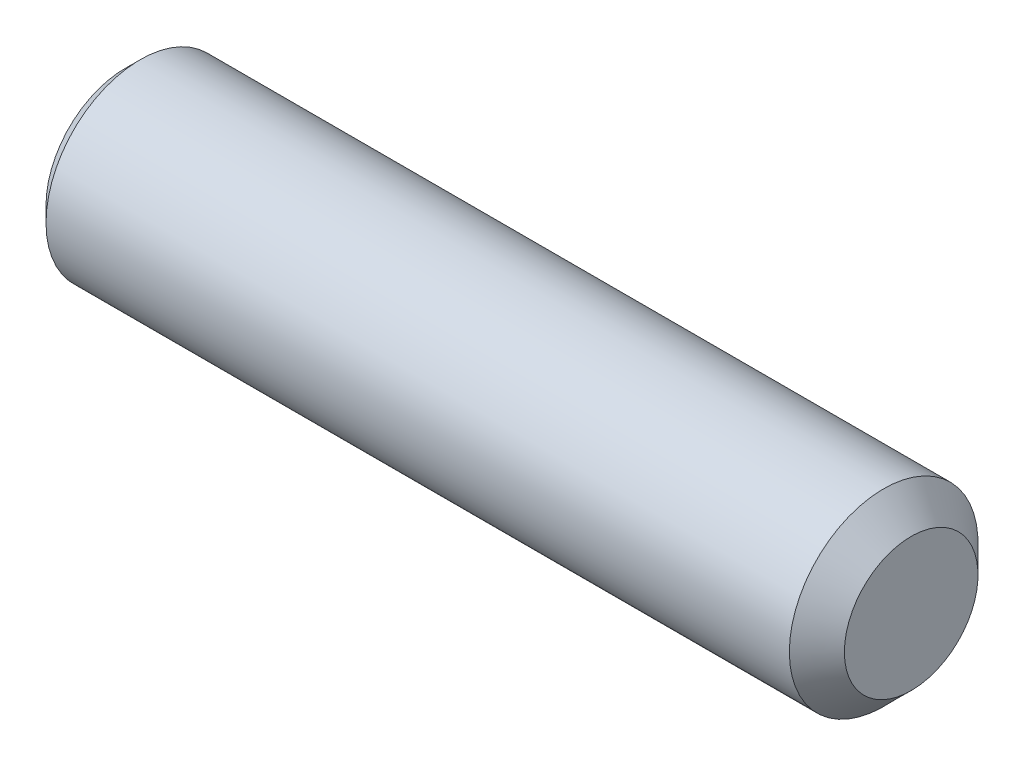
SolidWorks part; units mm, degrees
ref_plane "Front Plane" through (0, 0, 0) normal (0, 0, 1) x (1, 0, 0)
ref_plane "Top Plane" through (0, 0, 0) normal (0, 1, 0) x (1, 0, 0)
ref_plane "Right Plane" through (0, 0, 0) normal (1, 0, 0) x (0, 0, -1)
sketch "BodySke" plane through (0, 0, 0) normal (0, 0, 1) x (1, 0, 0)
  line L0 (0, 0) -> (88.3411, 0) construction
  line L1 (0, 0) -> (0, 5.036)
  line L2 (0, 5.036) -> (0.964, 6)
  line L3 (0.964, 6) -> (48.25, 6)
  line L4 (50, 4.25) -> (48.25, 6)
  line L5 (50, 4.25) -> (50, 0)
  line L6 (50, 0) -> (0, 0)
  line L7 (1.75, 0) -> (1.75, 8.5388) construction
  line L8 (0, -5.036) -> (0.964, -6) construction
  dimension "Diameter" = 12
  dimension "Thread_minor" = 10.072
  dimension "Length" = 50
  dimension "Cup_dia" = 8.5
  dimension "Nose_chamfer_angle" = 45
  dimension "Drive_chamfer_angle" = 90
  dimension "Advance" = 1.75
revolve "BaseBody" add sketch "BodySke" angle 360 about L0
sketch "CountersinkSke" plane through (0, 0, 0) normal (1, 0, 0) x (0, 0, -1)
  line L1 (0, 3.4641) -> (-3, 1.7321)
  line L2 (-3, 1.7321) -> (-3, -1.7321)
  line L3 (-3, -1.7321) -> (0, -3.4641)
  line L4 (0, -3.4641) -> (3, -1.7321)
  line L5 (3, -1.7321) -> (3, 1.7321)
  line L6 (3, 1.7321) -> (0, 3.4641)
  circle A0 centre (0, 0) radius 3 construction
  dimension "Countersink_width" = 6
extrude "Countersink" cut sketch "CountersinkSke" along normal blind 8
sketch "ThdSchSke" plane through (0, 0, 0) normal (0, 0, 1) x (1, 0, 0)
  line L0 (0, 0) -> (53.6961, 0) construction
  line L1 (1.6009, 7.1131) -> (1.6009, 6)
  line L2 (1.6009, 7.1131) -> (2.714, 7.1131)
  line L3 (2.714, 7.1131) -> (2.714, 6)
  line L4 (2.714, 6) -> (2.1574, 5.036)
  line L5 (2.1574, 5.036) -> (1.6009, 6)
  dimension "D1" = 1.75
revolve "ThreadSchematic" [suppressed] cut sketch "ThdSchSke" angle 360 about L0
pattern_linear "ThdSchPat" [suppressed]
equation "\"Thread_minor@ThreadCosmetic\" = \"Thread_minor@BodySke\""
equation "\"D1@ThdSchSke\" = \"Advance@BodySke\""
equation "\"Advance@ThdSchPat\" = \"Advance@BodySke\""
equation "\"Tooth_Num@ThdSchPat\" =  int( \"Length@BodySke\" / \"Advance@BodySke\" )  - 1"
